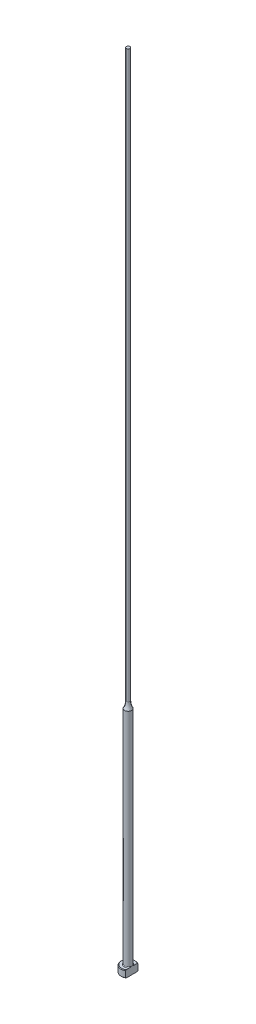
SolidWorks part; units mm, degrees
ref_plane "Front Plane" through (0, 0, 0) normal (0, 0, 1) x (1, 0, 0)
ref_plane "Top Plane" through (0, 0, 0) normal (0, 1, 0) x (1, 0, 0)
ref_plane "Right Plane" through (0, 0, 0) normal (1, 0, 0) x (0, 0, -1)
sketch "Sketch1" plane through (0, 0, 0) normal (0, 0, 1) x (1, 0, 0)
  line L0 (0, 259.9588) -> (0, -15.1925) construction
  line L1 (0, 0) -> (-3.175, 0)
  line L2 (-3.175, 0) -> (-3.175, 3.175)
  line L3 (-3.175, 3.175) -> (-1.5875, 3.175)
  line L4 (-0.7937, 104.6742) -> (-0.7937, 355.6)
  line L5 (-0.7937, 355.6) -> (0, 355.6)
  line L6 (0, 355.6) -> (0, 0)
  line L7 (-1.5875, 3.175) -> (-1.5875, 101.6)
  arc A0 (-1.5875, 101.6) -> (-0.7937, 104.6742) centre (-7.1437, 104.6742) ccw
  point P13 (-1.5875, 0)
  dimension "D1" = 6.35
  dimension "L" = 355.6
  dimension "D2" = 3.175
  dimension "H" = 6.35
  dimension "T" = 3.175
  dimension "D" = 1.5875
  dimension "S" = 101.6
revolve "Revolve1" add sketch "Sketch1" angle 360 about L0
chamfer "Chamfer1" distance 0.254 angle 45 2 edges at (0, 3.175, 3.175) (0, 0, 3.175)
fillet "Fillet1" radius 0.254 1 edges at (0, 3.175, 1.5875)
sketch "Sketch2" plane through (0, 0, 0) normal (0, 1, 0) x (1, 0, 0)
  line L0 (1.5875, -2.7496) -> (1.5875, 2.7496)
  circle A0 centre (0, 0) radius 3.175 construction
  arc A2 (1.5875, -2.7496) -> (1.5875, 2.7496) centre (0, 0) ccw
  circle A3 centre (0, 0) radius 3.175 construction
  circle A4 centre (0, 0) radius 1.5875 construction
extrude "Key Head" cut sketch "Sketch2" along normal up to next
